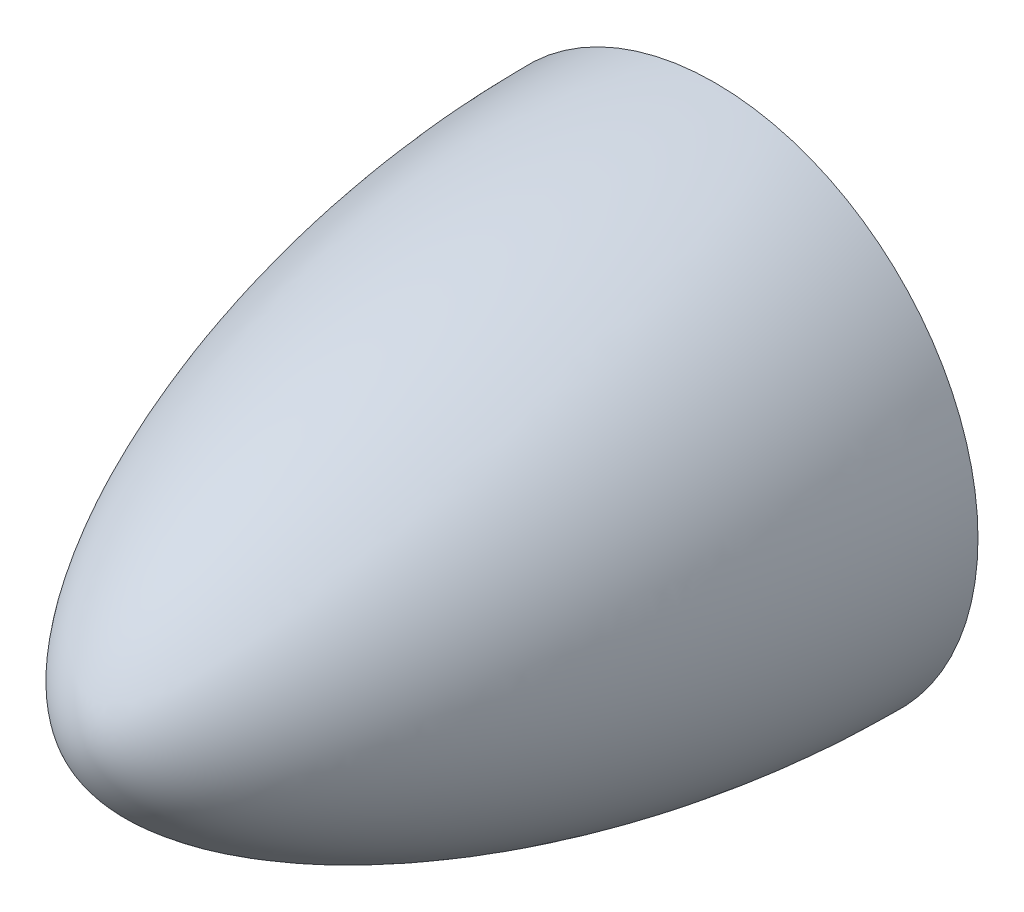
SolidWorks part; units mm, degrees
ref_plane "Plan de face" through (0, 0, 0) normal (0, 0, 1) x (1, 0, 0)
ref_plane "Plan de dessus" through (0, 0, 0) normal (0, 1, 0) x (1, 0, 0)
ref_plane "Plan de droite" through (0, 0, 0) normal (1, 0, 0) x (0, 0, -1)
sketch "Esquisse1" plane through (0, 0, 0) normal (1, 0, 0) x (0, 0, -1)
  line L0 (-14.3168, 0) -> (5.0836, 0) construction
  line L1 (0, -2.9719) -> (0, 6.1075) construction
  line L2 (-12, -2.9719) -> (-12, 6.8216) construction
  line L3 (5.0836, 5) -> (-12.7993, 5) construction
  line L4 (0, 5) -> (0, 0)
  line L5 (0, 0) -> (-12, 0)
  spline S0 degree 3 poles (0, 5) (-6.1796, 5.0083) (-11.9949, 2.2041) (-12, 0) knots 0 0 0 0 0.815099 0.815099 0.815099 0.815099
  dimension "D1" = 5
  dimension "D2" = 12
revolve "Révolution1" add sketch "Esquisse1" angle 360 about L0
sketch "Esquisse2" plane through (0, 0, 0) normal (0, 0, -1) x (-1, 0, 0)
  circle A0 centre (0, 0) radius 1
extrude "Enlèv. mat.-Extru.1" cut sketch "Esquisse2" against normal blind 3
